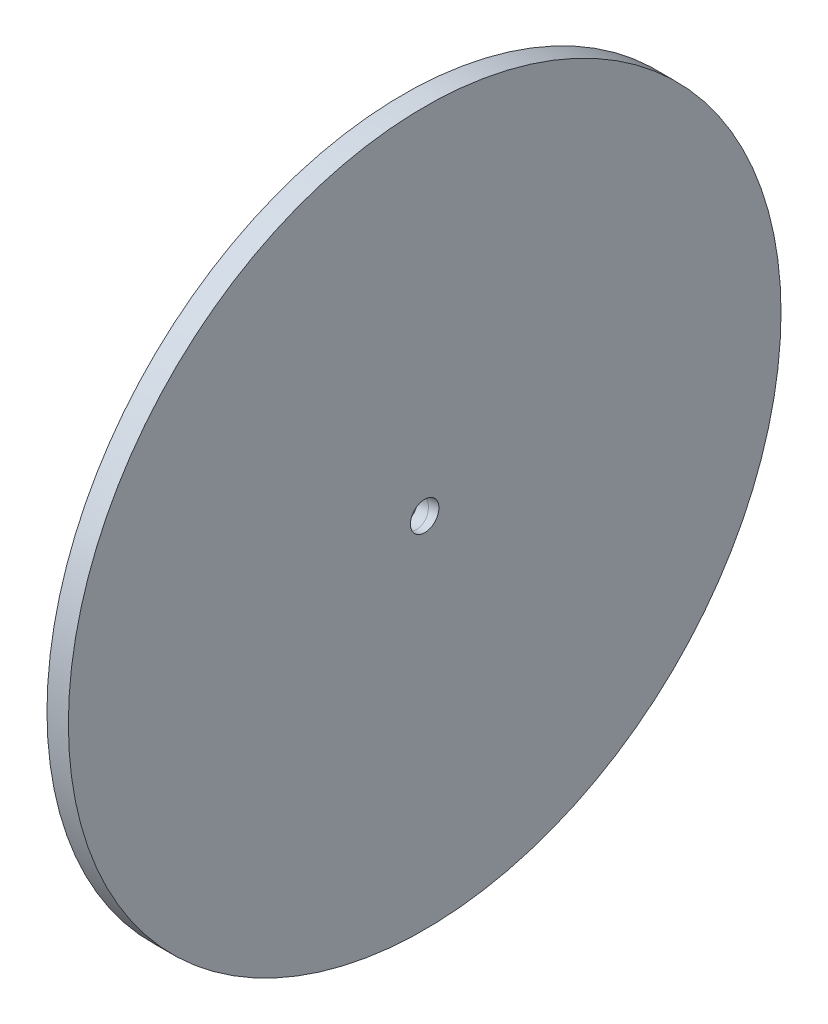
SolidWorks part; units mm, degrees
ref_plane "Front Plane" through (0, 0, 0) normal (0, 0, 1) x (1, 0, 0)
ref_plane "Top Plane" through (0, 0, 0) normal (0, 1, 0) x (1, 0, 0)
ref_plane "Right Plane" through (0, 0, 0) normal (1, 0, 0) x (0, 0, -1)
sketch "Sketch1" plane through (0, 0, 0) normal (1, 0, 0) x (0, 0, -1)
  circle A0 centre (0, 0) radius 50
  dimension "D1" = 100
extrude "Boss-Extrude1" add sketch "Sketch1" along normal blind 3
sketch "Sketch2" plane through (0, 0, 0) normal (0, 0, 1) x (1, 0, 0)
  line L0 (1.5, 0) -> (29.4431, 4.9271)
  line L1 (1.5, 0) -> (-24.7687, -4.6319)
  line L2 (0, 50) -> (0, -50) construction
  dimension "D1" = 100
sweep "Cut-Sweep1" cut path "Sketch2" parameters "D3"=4
